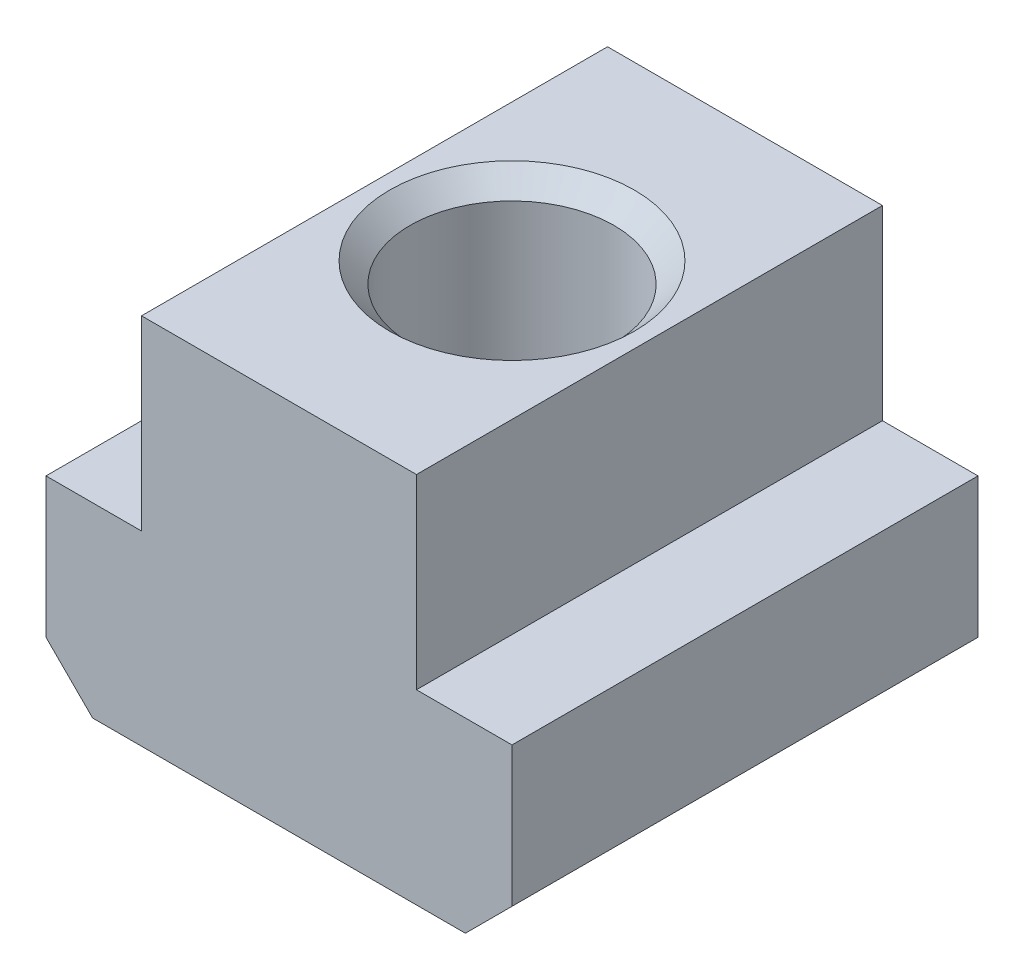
SolidWorks part; units mm, degrees
ref_plane "Plan de face" through (0, 0, 0) normal (0, 0, 1) x (1, 0, 0)
ref_plane "Plan de dessus" through (0, 0, 0) normal (0, 1, 0) x (1, 0, 0)
ref_plane "Plan de droite" through (0, 0, 0) normal (1, 0, 0) x (0, 0, -1)
sketch "Esquisse1" plane through (0, 0, 0) normal (0, 0, 1) x (1, 0, 0)
  line L0 (11.8, 0) -> (20, 0)
  line L1 (-20, 0) -> (-11.8, 0)
  line L2 (-20, 0) -> (-20, -16)
  line L3 (-20, -16) -> (20, -16)
  line L4 (20, 0) -> (20, -16)
  line L5 (-20, 0) -> (20, -16) construction
  line L6 (-20, -16) -> (20, 0) construction
  line L7 (-11.8, 16) -> (11.8, 16)
  line L8 (-11.8, 16) -> (-11.8, 0)
  line L9 (0, 0) -> (0, 18.3915) construction
  line L10 (11.8, 16) -> (11.8, 0)
  line L11 (-11.8, 16) -> (11.8, 0) construction
  line L12 (-11.8, 0) -> (11.8, 16) construction
  point P0 (0, -8)
  point P5 (0, 8)
  dimension "D1" = 23.6
  dimension "D2" = 40
  dimension "D3" = 32
  dimension "D4" = 16
extrude "Boss.-Extru.1" add sketch "Esquisse1" along normal mid plane 40
hole_wizard "Trou taraudé M201" positions "Esquisse3" profile "Esquisse2" tap size "M20" standard "Iso"
sketch "Esquisse3" plane through (0, 16, 0) normal (0, 1, 0) x (1, 0, 0)
  point P0 (0, 0)
sketch "Esquisse2" plane through (0, 16, 0) normal (1, 0, 0) x (0, 0, 1)
  line L0 (0, 0) -> (0, 32)
  line L1 (0, 32) -> (8.75, 32)
  line L2 (8.75, 32) -> (8.75, 1.75)
  line L3 (8.75, 1.75) -> (10.5, 0)
  line L5 (10.5, 0) -> (0, 0)
  line L6 (-8.75, 1.75) -> (-10.5, 0) construction
  line L11 (0, -6.35) -> (0, 107.95) construction
  dimension "Diamètre du trou pour taraudage jusqu'au prochain" = 17.5
  dimension "Profondeur du trou pour taraudage jusqu'au prochain" = 32
  dimension "Diamètre du fraisage entrant" = 21
  dimension "Angle du fraisage entrant" = 90
chamfer "Chanfrein1" distance 4 angle 45 2 edges at (-20, -16, 0) (20, -16, 0)
